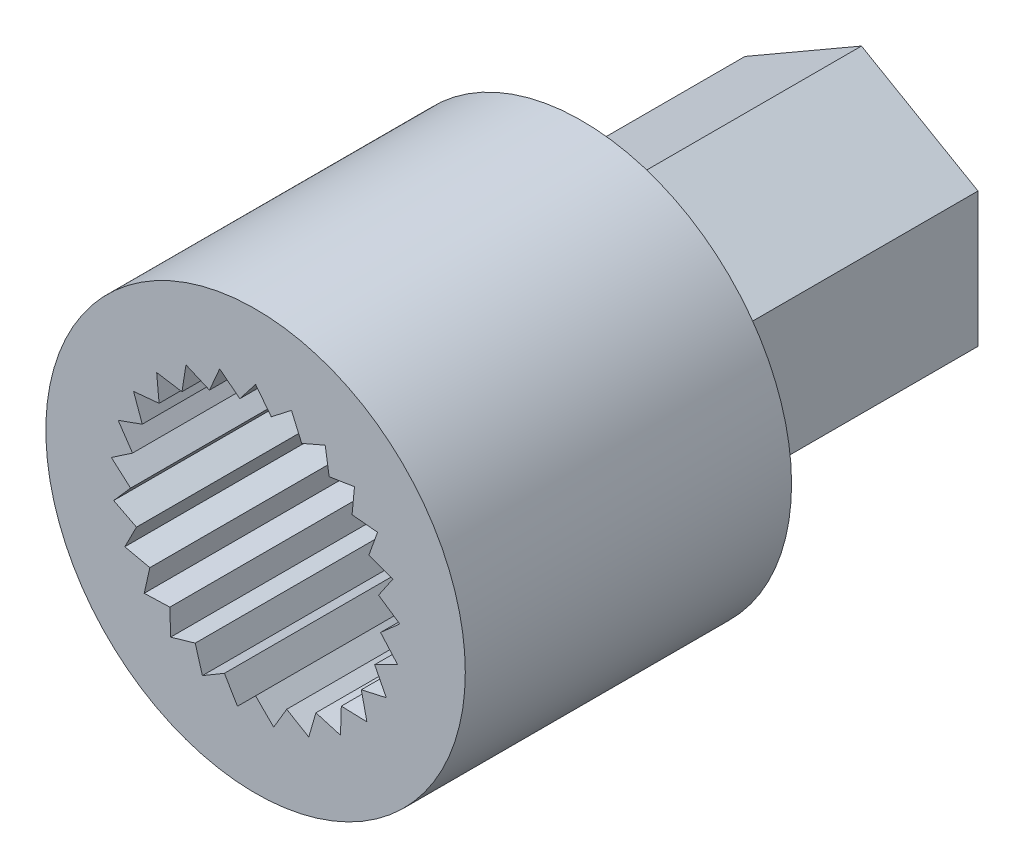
SolidWorks part; units mm, degrees
ref_plane "Ebene vorne" through (0, 0, 0) normal (0, 0, 1) x (1, 0, 0)
ref_plane "Ebene oben" through (0, 0, 0) normal (0, 1, 0) x (1, 0, 0)
ref_plane "Ebene rechts" through (0, 0, 0) normal (1, 0, 0) x (0, 0, -1)
sketch "Skizze1" plane through (0, 0, 0) normal (0, 0, 1) x (1, 0, 0)
  line L0 (0, 1.55) -> (0.1684, 1.3329)
  line L1 (0.1684, 1.3329) -> (0.3855, 1.5013)
  line L2 (0, 1.55) -> (0.3855, 1.5013) construction
  line L3 (0.1927, 1.5257) -> (0, 0) construction
  line L4 (0, 0) -> (0, 4.5319) construction
  line L5 (0, 0) -> (0.3855, 1.5013) construction
  line L6 (0.3855, 1.5013) -> (0.4946, 1.2492)
  line L7 (0.4946, 1.2492) -> (0.7467, 1.3583)
  line L8 (0.7467, 1.3583) -> (0.7897, 1.0869)
  line L9 (0.7897, 1.0869) -> (1.061, 1.1299)
  line L10 (1.061, 1.1299) -> (1.0352, 0.8564)
  line L11 (1.0352, 0.8564) -> (1.3087, 0.8305)
  line L12 (1.3087, 0.8305) -> (1.2156, 0.572)
  line L13 (1.2156, 0.572) -> (1.4741, 0.479)
  line L14 (1.4741, 0.479) -> (1.3197, 0.2517)
  line L15 (1.3197, 0.2517) -> (1.5469, 0.0973)
  line L16 (1.5469, 0.0973) -> (1.3409, -0.0844)
  line L17 (1.3409, -0.0844) -> (1.5225, -0.2904)
  line L18 (1.5225, -0.2904) -> (1.2778, -0.4152)
  line L19 (1.2778, -0.4152) -> (1.4025, -0.66)
  line L20 (1.4025, -0.66) -> (1.1344, -0.7199)
  line L21 (1.1344, -0.7199) -> (1.1943, -0.988)
  line L22 (1.1943, -0.988) -> (0.9197, -0.9794)
  line L23 (0.9197, -0.9794) -> (0.9111, -1.254)
  line L24 (0.9111, -1.254) -> (0.6472, -1.1773)
  line L25 (0.6472, -1.1773) -> (0.5706, -1.4412)
  line L26 (0.5706, -1.4412) -> (0.3341, -1.3013)
  line L27 (0.3341, -1.3013) -> (0.1943, -1.5378)
  line L28 (0.1943, -1.5378) -> (0, -1.3435)
  line L29 (0, -1.3435) -> (-0.1943, -1.5378)
  line L30 (-0.1943, -1.5378) -> (-0.3341, -1.3013)
  line L31 (-0.3341, -1.3013) -> (-0.5706, -1.4412)
  line L32 (-0.5706, -1.4412) -> (-0.6472, -1.1773)
  line L33 (-0.6472, -1.1773) -> (-0.9111, -1.254)
  line L34 (-0.9111, -1.254) -> (-0.9197, -0.9794)
  line L35 (-0.9197, -0.9794) -> (-1.1943, -0.988)
  line L36 (-1.1943, -0.988) -> (-1.1344, -0.7199)
  line L37 (-1.1344, -0.7199) -> (-1.4025, -0.66)
  line L38 (-1.4025, -0.66) -> (-1.2778, -0.4152)
  line L39 (-1.2778, -0.4152) -> (-1.5225, -0.2904)
  line L40 (-1.5225, -0.2904) -> (-1.3409, -0.0844)
  line L41 (-1.3409, -0.0844) -> (-1.5469, 0.0973)
  line L42 (-1.5469, 0.0973) -> (-1.3197, 0.2517)
  line L43 (-1.3197, 0.2517) -> (-1.4741, 0.479)
  line L44 (-1.4741, 0.479) -> (-1.2156, 0.572)
  line L45 (-1.2156, 0.572) -> (-1.3087, 0.8305)
  line L46 (-1.3087, 0.8305) -> (-1.0352, 0.8564)
  line L47 (-1.0352, 0.8564) -> (-1.061, 1.1299)
  line L48 (-1.061, 1.1299) -> (-0.7897, 1.0869)
  line L49 (-0.7897, 1.0869) -> (-0.7467, 1.3583)
  line L50 (-0.7467, 1.3583) -> (-0.4946, 1.2492)
  line L51 (-0.4946, 1.2492) -> (-0.3855, 1.5013)
  line L52 (-0.3855, 1.5013) -> (-0.1684, 1.3329)
  line L53 (-0.1684, 1.3329) -> (0, 1.55)
  circle A0 centre (0, 0) radius 1.55 construction
  circle A1 centre (0, 0) radius 2.25
  point P68 (0, 0)
extrude "Aufsatz-Linear austragen1" add sketch "Skizze1" along normal blind 2.5 contours A1 L42 L43 L0 L1 L6 L7 L8 L9 L10 L11 L12 L13 L14 L15 L16 L17 L18 L19 L20 L21 L22 L23 L24 L25 L26 L27 L28 L29 L30 L31 L32 L33 L34 L35 L36 L37 L38 L39 L40 L41
sketch "Skizze2" plane through (0, 0, 0) normal (0, 0, 1) x (1, 0, 0)
  circle A0 centre (0, 0) radius 2.25 construction
  circle A1 centre (0, 0) radius 2.25
extrude "Aufsatz-Linear austragen2" add sketch "Skizze2" against normal blind 1
sketch "Skizze3" plane through (0, 0, -1) normal (0, 0, -1) x (-1, 0, 0)
  line L0 (0, 0) -> (0, -1.4434) construction
  line L1 (0, -1.4434) -> (-1.25, -0.7217)
  line L2 (-1.25, -0.7217) -> (0, 0) construction
  line L3 (-0.625, -1.0825) -> (0, 0) construction
  line L4 (-1.25, -0.7217) -> (-1.25, 0.7217)
  line L5 (-1.25, 0.7217) -> (0, 1.4434)
  line L6 (0, 1.4434) -> (1.25, 0.7217)
  line L7 (1.25, 0.7217) -> (1.25, -0.7217)
  line L8 (1.25, -0.7217) -> (0, -1.4434)
  point P18 (0, 0)
  dimension "D1" = 60
  dimension "D2" = 1.25
  dimension "D3" = 6
extrude "Aufsatz-Linear austragen3" add sketch "Skizze3" along normal blind 3
equation "\"D2@Skizze1\"=360/25"
